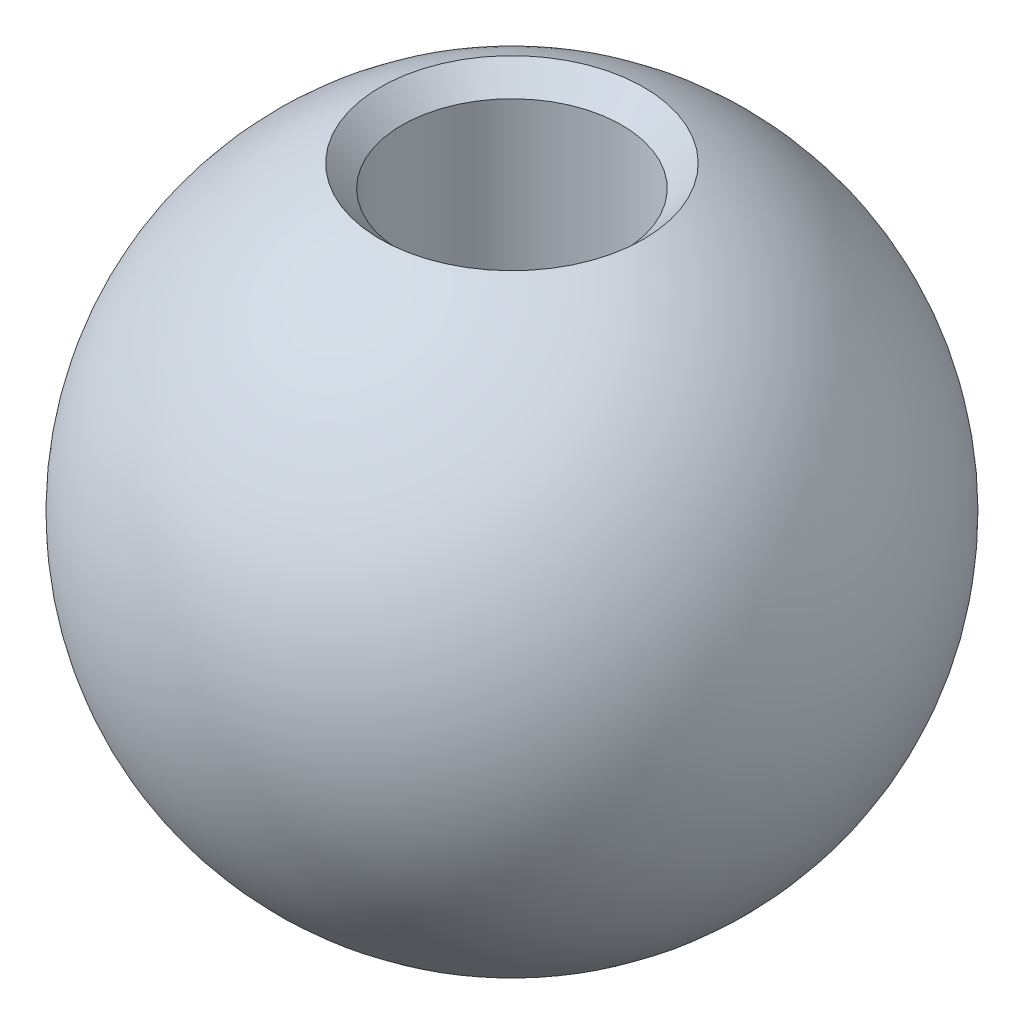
SolidWorks part; units mm, degrees
ref_plane "Front Plane" through (0, 0, 0) normal (0, 0, 1) x (1, 0, 0)
ref_plane "Top Plane" through (0, 0, 0) normal (0, 1, 0) x (1, 0, 0)
ref_plane "Right Plane" through (0, 0, 0) normal (1, 0, 0) x (0, 0, -1)
sketch "Sketch2" plane through (0, 0, 0) normal (0, 0, 1) x (1, 0, 0)
  line L0 (0, -5.5) -> (0, 5.5) construction
  line L1 (0, 5.5) -> (9.8806, 5.5) construction
  line L2 (2, -5.5) -> (2.3979, -5.5)
  line L3 (2.3979, -5.5) -> (0, -5.5) construction
  line L4 (2, -5.5) -> (2, 5.1021)
  line L5 (2, 5.1021) -> (2.3979, 5.5)
  arc A0 (2.3979, -5.5) -> (2.3979, 5.5) centre (0, 0) ccw
  point P3 (0, 0)
  dimension "D2" = 6
  dimension "D1" = 11
  dimension "D3" = 2
  dimension "D4" = 45
revolve "Revolve1" add sketch "Sketch2" angle 360 about L0
